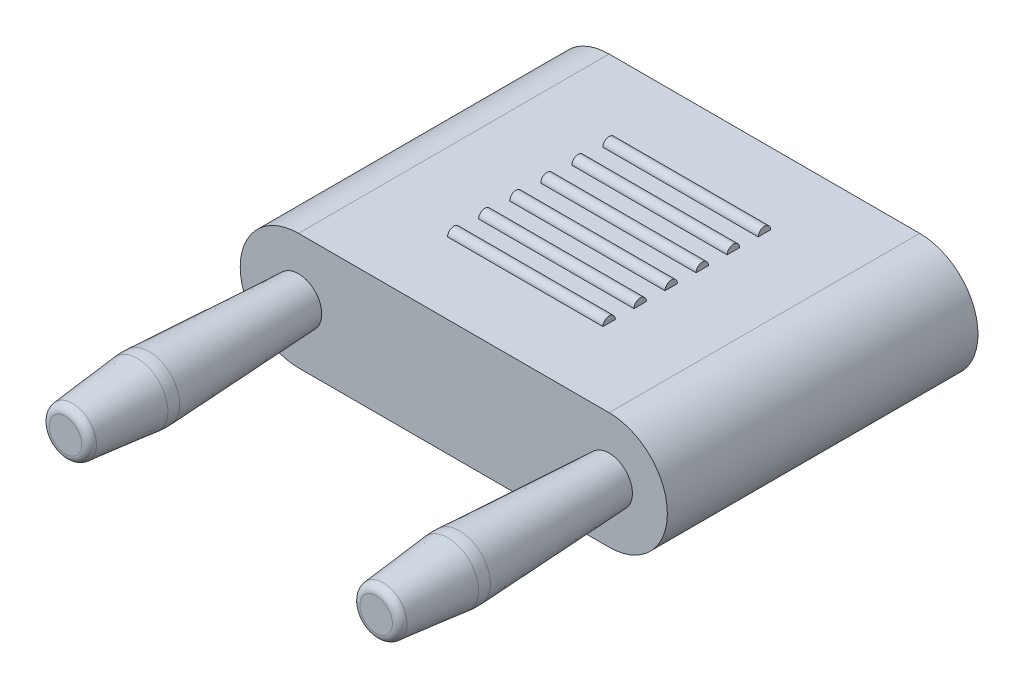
SolidWorks part; units mm, degrees
ref_plane "Front Plane" through (0, 0, 0) normal (0, 0, 1) x (1, 0, 0)
ref_plane "Top Plane" through (0, 0, 0) normal (0, 1, 0) x (1, 0, 0)
ref_plane "Right Plane" through (0, 0, 0) normal (1, 0, 0) x (0, 0, -1)
sketch "Sketch1" plane through (0, 0, 0) normal (0, 0, 1) x (1, 0, 0)
  line L0 (-12.7, 4.7625) -> (12.7, -4.7625) construction
  line L1 (-12.7, 4.7625) -> (12.7, 4.7625)
  line L3 (-12.7, -4.7625) -> (12.7, -4.7625)
  arc A0 (-12.7, 4.7625) -> (-12.7, -4.7625) centre (-12.7, 0) ccw
  arc A1 (12.7, 4.7625) -> (12.7, -4.7625) centre (12.7, 0) cw
  point P4 (0, 0)
  dimension "D1" = 25.4
  dimension "D2" = 9.525
extrude "Extrude1" add sketch "Sketch1" along normal blind 25.4
sketch "Sketch2" plane through (0, 0, 0) normal (0, 1, 0) x (1, 0, 0)
  line L0 (-12.7, -25.4) -> (-12.7, -44.45) construction
  line L1 (-14.605, -25.4) -> (-15.2162, -37.6246)
  line L3 (-15.1926, -38.5736) -> (-14.6622, -43.8782)
  line L4 (-14.0303, -44.45) -> (-12.7, -44.45)
  line L5 (-14.605, -25.4) -> (-12.7, -25.4)
  line L6 (-12.7, -25.4) -> (-12.7, -44.45)
  arc A0 (-15.2162, -37.6246) -> (-15.1926, -38.5736) centre (-8.8742, -37.9417) ccw
  arc A1 (-14.0303, -44.45) -> (-14.6622, -43.8782) centre (-14.0303, -43.815) cw
  point P7 (-15.24, -38.1)
  point P11 (-14.605, -44.45)
  dimension "D5" = 6.35
  dimension "D6" = 0.635
  dimension "D1" = 5.08
  dimension "D2" = 19.05
  dimension "D3" = 12.7
  dimension "D4" = 3.81
revolve "Revolve1" add sketch "Sketch2" angle 360 about L6
sketch "Sketch3" plane through (0, 0, 0) normal (0, 0, -1) x (-1, 0, 0)
  circle A0 centre (12.7, 0) radius 1.905
  circle A2 centre (12.7, 0) radius 1.905 construction
  dimension "D1" = 3.81
extrude "Cut-Extrude1" cut sketch "Sketch3" against normal blind 6.35
pattern_linear "LPattern1" count 2 spacing 25.4 along (1, 0, 0) of "Revolve1", "Cut-Extrude1"
sketch "Sketch4" plane through (0, 0, 0) normal (1, 0, 0) x (0, 0, -1)
  line L0 (-25.4, 4.7625) -> (0, 4.7625) construction
  line L2 (-25.4, 4.7625) -> (-25.4, -4.7625) construction
  line L3 (-19.558, 4.7625) -> (-18.542, 4.7625)
  arc A0 (-18.542, 4.7625) -> (-19.558, 4.7625) centre (-19.05, 4.7625) ccw
  dimension "D2" = 0.508
  dimension "D1" = 6.35
extrude "Extrude2" add sketch "Sketch4" along normal mid plane 12.7
pattern_linear "LPattern2" count 6 spacing 2.54 along (0, 0, -1) of "Extrude2"
